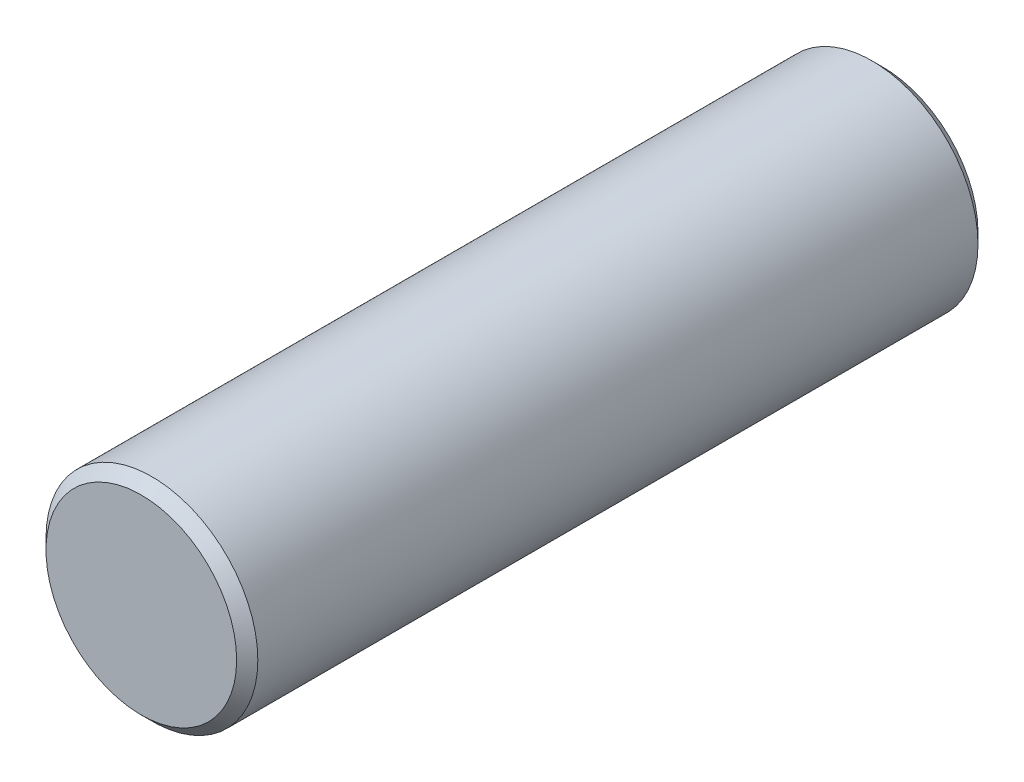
SolidWorks part; units mm, degrees
ref_plane "Plan de face" through (0, 0, 0) normal (0, 0, 1) x (1, 0, 0)
ref_plane "Plan de dessus" through (0, 0, 0) normal (0, 1, 0) x (1, 0, 0)
ref_plane "Plan de droite" through (0, 0, 0) normal (1, 0, 0) x (0, 0, -1)
sketch "Esquisse1" plane through (0, 0, 0) normal (0, 0, 1) x (1, 0, 0)
  circle A0 centre (0, 0) radius 2
  dimension "D1" = 4
extrude "Boss.-Extru.1" add sketch "Esquisse1" along normal blind 14
chamfer "Chanfrein1" distance 0.2 angle 45 2 edges at (2, 0, 0) (2, 0, 14)
